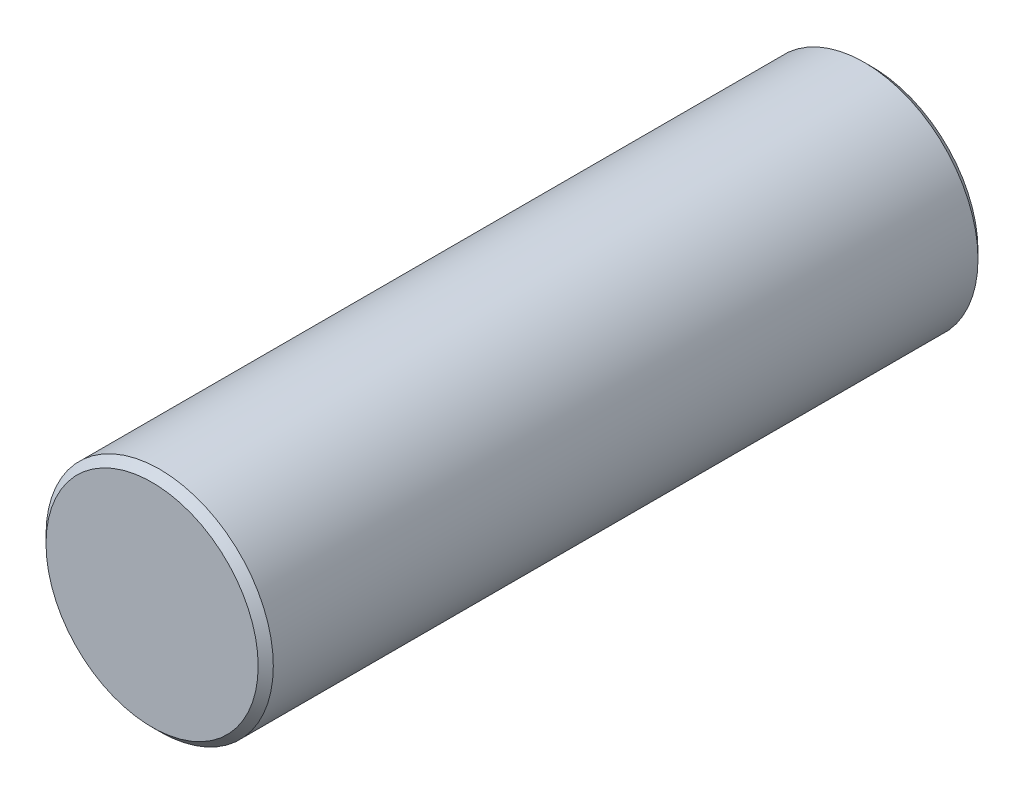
SolidWorks part; units mm, degrees
ref_plane "Face" through (0, 0, 0) normal (0, 0, 1) x (1, 0, 0)
ref_plane "Dessus" through (0, 0, 0) normal (0, 1, 0) x (1, 0, 0)
ref_plane "Droite" through (0, 0, 0) normal (1, 0, 0) x (0, 0, -1)
sketch "Esquisse1" plane through (0, 0, 0) normal (0, 0, 1) x (1, 0, 0)
  circle A0 centre (0, 0) radius 1.5
  dimension "D1" = 3
extrude "Cylindre de base" add sketch "Esquisse1" along normal mid plane 9.5
chamfer "Chanfreins" distance 0.1 angle 45
